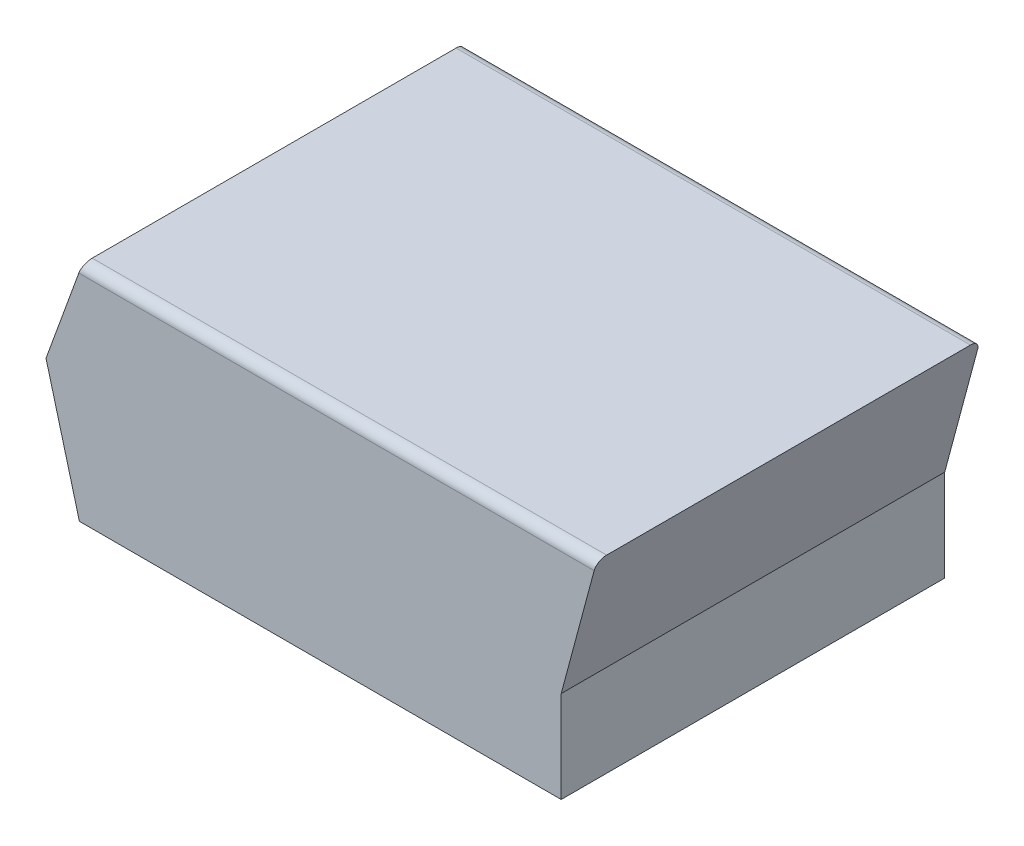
SolidWorks part; units mm, degrees
ref_plane "Front Plane" through (0, 0, 0) normal (0, 0, 1) x (1, 0, 0)
ref_plane "Top Plane" through (0, 0, 0) normal (0, 1, 0) x (1, 0, 0)
ref_plane "Right Plane" through (0, 0, 0) normal (1, 0, 0) x (0, 0, -1)
sketch "Sketch1" plane through (0, 0, 0) normal (0, 0, 1) x (1, 0, 0)
  line L0 (0, 0) -> (1470, 0)
  line L1 (1470, 0) -> (1470, 280)
  line L2 (1470, 280) -> (1578.5194, 685)
  line L3 (1578.5194, 685) -> (9.1902, 685)
  line L4 (9.1902, 685) -> (-101.8207, 380)
  line L5 (-101.8207, 380) -> (0, 0)
  dimension "D1" = 1470
  dimension "D2" = 105
  dimension "D3" = 305
  dimension "D4" = 685
  dimension "D5" = 110
  dimension "D6" = 280
  dimension "D7" = 165
extrude "Boss-Extrude1" add sketch "Sketch1" along normal blind 1170
fillet "Fillet1" radius 30 2 edges at (793.8548, 685, 0) (793.8548, 685, 1170)
ref_plane "Plane1" through (0, 0, 0) normal (-1, 0, 0) x (0, 0, 1)
sketch "Sketch2" plane through (0, 0, 0) normal (-1, 0, 0) x (0, 0, 1)
  line L0 (585, 0) -> (585, 155) construction
  line L1 (1170, 0) -> (0, 0) construction
  line L2 (385, 155) -> (385, 0)
  line L3 (385, 0) -> (785, 0)
  line L4 (785, 0) -> (785, 155)
  arc A0 (785, 155) -> (385, 155) centre (585, 155) ccw
  dimension "D1" = 200
  dimension "D2" = 155
extrude "Cut-Extrude1" cut sketch "Sketch2" along normal through all and the other way blind 50
ref_plane "Plane2" through (0, 0, 585) normal (0, 0, 1) x (1, 0, 0)
